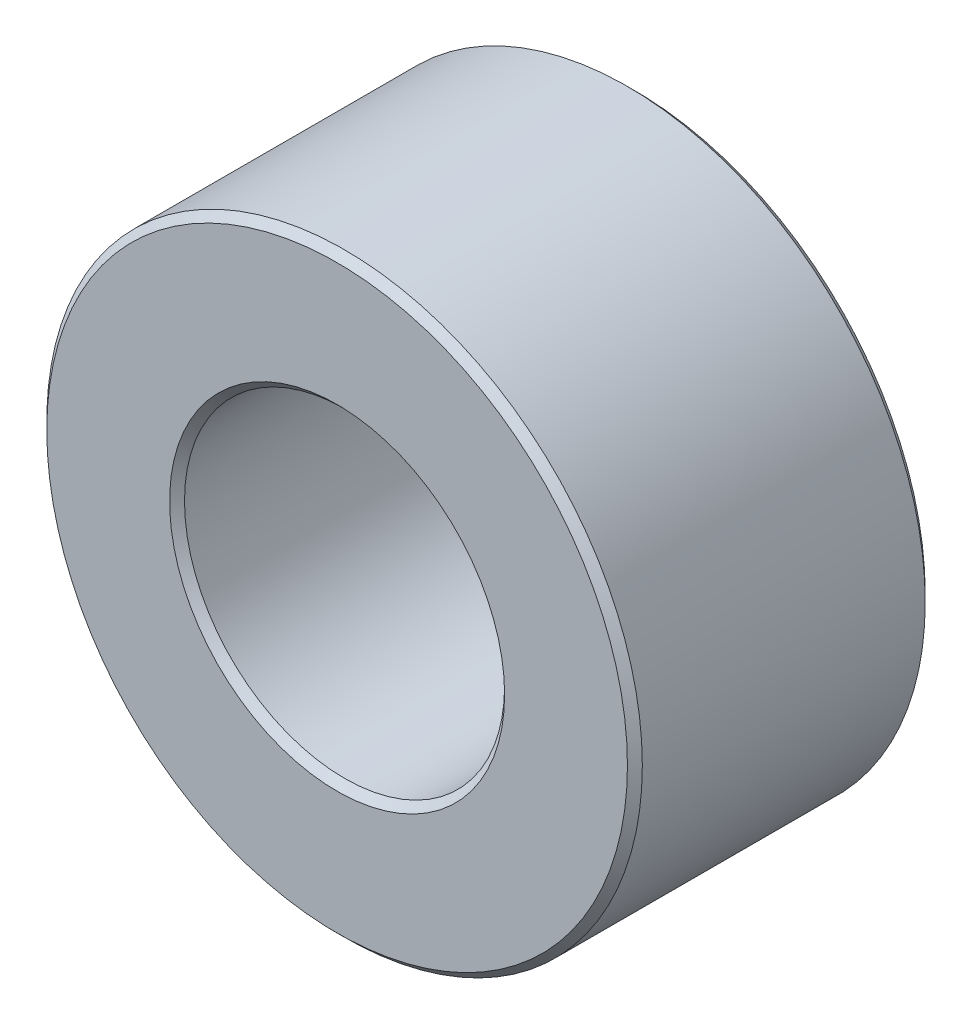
SolidWorks part; units mm, degrees
ref_plane "Front Plane" through (0, 0, 0) normal (0, 0, 1) x (1, 0, 0)
ref_plane "Top Plane" through (0, 0, 0) normal (0, 1, 0) x (1, 0, 0)
ref_plane "Right Plane" through (0, 0, 0) normal (1, 0, 0) x (0, 0, -1)
sketch "Sketch1" plane through (0, 0, 0) normal (0, 0, 1) x (1, 0, 0)
  circle A0 centre (0, 0) radius 4
  circle A1 centre (0, 0) radius 2.15
  dimension "D1" = 8
  dimension "D2" = 4.3
extrude "Boss-Extrude2" add sketch "Sketch1" along normal mid plane 4
chamfer "Chamfer3" distance 0.1 angle 45 4 edges at (4, 0, 2) (4, 0, -2) (2.15, 0, -2) (2.15, 0, 2)
